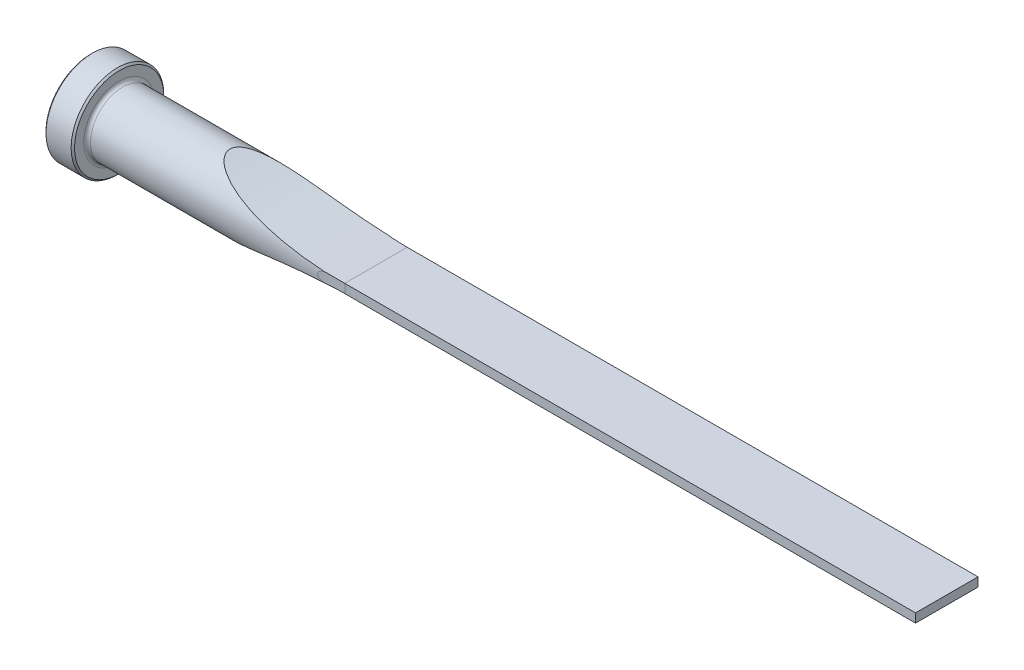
SolidWorks part; units mm, degrees
ref_plane "Front Plane" through (0, 0, 0) normal (0, 0, 1) x (1, 0, 0)
ref_plane "Top Plane" through (0, 0, 0) normal (0, 1, 0) x (1, 0, 0)
ref_plane "Right Plane" through (0, 0, 0) normal (1, 0, 0) x (0, 0, -1)
sketch "Sketch1" plane through (0, 0, 0) normal (0, 0, 1) x (1, 0, 0)
  line L0 (0, 0) -> (175.5286, 0) construction
  line L1 (0, 0) -> (0, 10.3124)
  line L2 (0, 10.3124) -> (6.35, 10.3124)
  line L3 (6.35, 10.3124) -> (6.35, 7.1437)
  line L4 (6.35, 7.1437) -> (190.5, 7.1437)
  line L5 (190.5, 7.1437) -> (190.5, 0)
  line L6 (190.5, 0) -> (0, 0)
  dimension "D1" = 190.5
  dimension "D2" = 20.6248
  dimension "D3" = 14.2875
  dimension "D4" = 6.35
revolve "Revolve1" add sketch "Sketch1" angle 360 about L0
sketch "Sketch2" plane through (0, 0, 0) normal (0, 0, 1) x (1, 0, 0)
  line L0 (190.5, 7.1437) -> (190.5, 0.9906)
  line L1 (190.5, -7.1437) -> (190.5, 7.1437) construction
  line L2 (190.5, 0.9906) -> (63.5, 0.9906)
  line L3 (190.5, 7.1437) -> (6.35, 7.1437) construction
  line L4 (31.0012, 7.1438) -> (190.5, 7.1437)
  line L5 (166.0833, 0) -> (153.1705, 0) construction
  arc A0 (63.5, 0.9906) -> (31.0012, 7.1438) centre (63.5, 89.8906) cw
  dimension "D1" = 88.9
  dimension "D3" = 127
  dimension "D2" = 1.9812
  dimension "D4" = 32.4988
extrude "Cut-Extrude1" cut sketch "Sketch2" against normal through all both and the other way through all
mirror "Mirror1" about plane through (0, 0, 0) normal (0, 1, 0) of "Cut-Extrude1"
sketch "Sketch3" plane through (0, 0, 0) normal (0, 1, 0) x (1, 0, 0)
  line L0 (190.5, 7.1437) -> (190.5, 6.9469)
  line L1 (190.5, 7.0747) -> (190.5, -7.0747) construction
  line L2 (190.5, 6.9469) -> (63.5, 6.9469)
  line L3 (190.5, 7.1437) -> (6.35, 7.1437) construction
  line L4 (57.5872, 7.1438) -> (190.5, 7.1437)
  line L5 (163.4716, 0) -> (166.2513, 0) construction
  line L6 (63.5, 7.0747) -> (63.5, -7.0747) construction
  arc A0 (63.5, 6.9469) -> (57.5872, 7.1438) centre (63.5, 95.8469) cw
  dimension "D2" = 88.9
  dimension "D1" = 13.8938
extrude "Cut-Extrude2" cut sketch "Sketch3" against normal through all both and the other way through all
mirror "Mirror2" about plane through (0, 0, 0) normal (0, 0, 1) of "Cut-Extrude2"
fillet "Fillet1" radius 0.762 1 edges at (6.35, 0, 7.1437)
chamfer "Chamfer1" distance 0.381 angle 45 2 edges at (0, 0, 10.3124) (6.35, 0, 10.3124)
